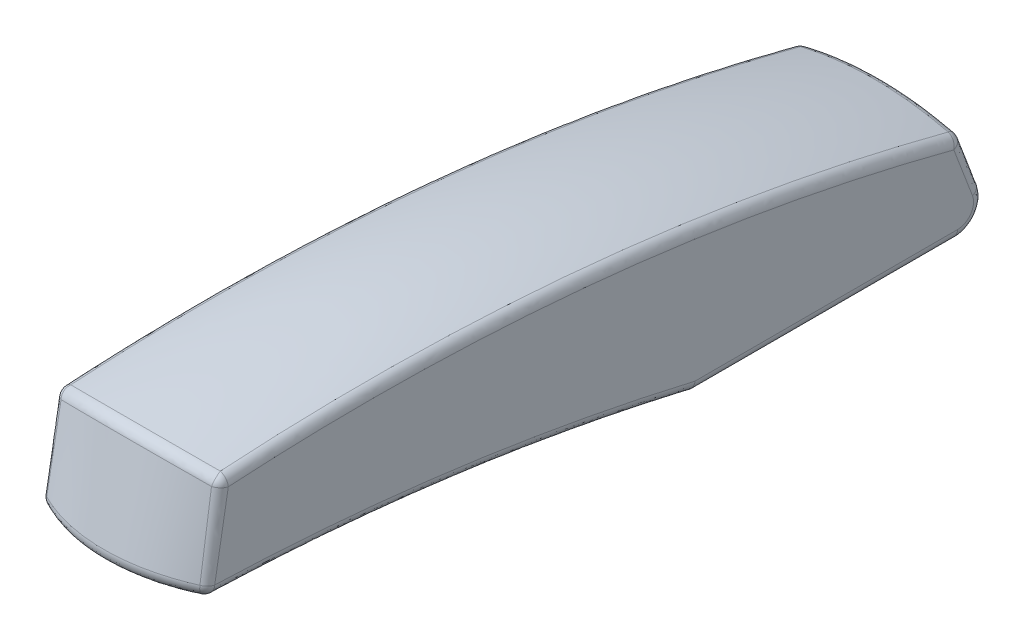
SolidWorks part; units mm, degrees
ref_plane "Front Plane" through (0, 0, 0) normal (0, 0, 1) x (1, 0, 0)
ref_plane "Top Plane" through (0, 0, 0) normal (0, 1, 0) x (1, 0, 0)
ref_plane "Right Plane" through (0, 0, 0) normal (1, 0, 0) x (0, 0, -1)
sketch "Sketch1" plane through (0, 0, 0) normal (1, 0, 0) x (0, 0, -1)
  line L2 (-91, 11.8614) -> (-88.1255, 29.8614)
  line L6 (0, 0) -> (56.5385, 0)
  line L7 (50.0745, 16.4998) -> (56.5385, 0)
  arc A1 (0, 0) -> (-91, 11.8614) centre (-103.1004, -435.9751) ccw
  arc A4 (-88.1255, 29.8614) -> (50.0745, 16.4998) centre (-59.8633, -399.2088) cw
  dimension "D7" = 430
  dimension "D2" = 50.0745
  dimension "D10" = 448
  dimension "D3" = 56.5385
  dimension "D4" = 59.8633
  dimension "D5" = 91
  dimension "D6" = 18
  dimension "D8" = 138.2
  dimension "D9" = 103.1004
ref_plane "Plane1" through (30.7, 0, 0) normal (1, 0, 0) x (0, 0, -1)
sketch "Sketch2" plane through (30.7, 0, 0) normal (1, 0, 0) x (0, 0, -1)
  line L0 (-88.1255, 29.8614) -> (-91, 11.8614)
  line L5 (0, 0) -> (56.5385, 0)
  line L7 (56.5385, 0) -> (50.0745, 16.4998)
  arc A0 (-91, 11.8614) -> (0, 0) centre (-103.1004, -435.9751) cw
  arc A2 (-88.1255, 29.8614) -> (50.0745, 16.4998) centre (-59.8633, -399.2088) cw
  dimension "D1" = 448
  dimension "D2" = 430
  dimension "D3" = 56.5385
ref_plane "Plane2" through (0, 0, 88.13) normal (0, 0, 1) x (1, 0, 0)
ref_plane "Plane3" through (0, 0, -50.07) normal (0, 0, 1) x (1, 0, 0)
sketch "Sketch5" plane through (0, 0, -50.07) normal (0, 0, 1) x (1, 0, 0)
  line L0 (30.7, 29.8614) -> (30.7, 11.8614) construction
  line L1 (0, 11.8614) -> (0, 29.8614) construction
  arc A0 (30.7, 16.4594) -> (0, 16.4594) centre (15.35, -38.4348) ccw
  dimension "D1" = 57
  dimension "D2" = 16.4594
ref_plane "Plane4" through (0, 0, 91) normal (0, 0, 1) x (1, 0, 0)
sketch "Sketch7" plane through (0, 0, 0) normal (0, 1, 0) x (1, 0, 0)
  line L0 (0, 0) -> (30.7, 0)
  line L1 (30.7, 0) -> (30.7, 56.5385) construction
sketch "Sketch8" plane through (0, 0, 0) normal (0, 1, 0) x (1, 0, 0)
  line L0 (0, 56.5385) -> (30.7, 56.5385)
  line L1 (0, 0) -> (0, 56.5385) construction
  line L2 (30.7, 0) -> (30.7, 56.5385) construction
  dimension "D1" = 56.5385
sketch "Sketch9" plane through (0, 0, 88.13) normal (0, 0, 1) x (1, 0, 0)
sketch "Sketch16" plane through (0, 0, 88.13) normal (0, 0, 1) x (1, 0, 0)
  line L0 (0, 29.8614) -> (30.7, 29.8614) construction
  line L1 (0, 11.8614) -> (0, 29.8614) construction
  line L2 (30.7, 29.8614) -> (30.7, 11.8614) construction
ref_plane "Plane9" through (0, -29.1343, 29.1343) normal (0, -0.7071, 0.7071) x (1, 0, 0)
sketch "Sketch17" plane through (0, -29.1343, 29.1343) normal (0, -0.7071, 0.7071) x (1, 0, 0)
  arc A0 (0, 83.4325) -> (30.7, 83.4325) centre (15.35, 51.9782) cw
  dimension "D1" = 35
ref_plane "Plane10" through (0, 3.8703, -0.3386) normal (0, -0.9962, 0.0872) x (1, 0, 0)
sketch "Sketch18" plane through (0, 3.8703, -0.3386) normal (0, -0.9962, 0.0872) x (1, 0, 0)
  arc A0 (-0.2904, 92.2166) -> (31.1985, 92.2166) centre (15.454, 66.6801) cw
  dimension "D1" = 30
loft "Loft11" add profiles "Sketch1", "Sketch2"
fillet "Fillet4" radius 5 1 edges
shell "Shell2" thickness 2.5
sketch "Sketch20" plane through (2.5, 0, 0) normal (1, 0, 0) x (0, 0, -1)
  line L0 (50.761, 15.2685) -> (53.9771, 6.7685)
  line L2 (51.4771, 4) -> (47.4771, 4)
  line L3 (47.4771, 4) -> (47.4771, 0)
  line L4 (0, 0) -> (49.2974, 0) construction
  line L5 (47.4771, 0) -> (46.4771, 0)
  line L6 (46.4771, 0) -> (46.4771, 16)
  line L8 (47.4771, 15.9) -> (47.4771, 10.4)
  line L9 (50.761, 15.2685) -> (49.761, 15.0856)
  line L10 (49.761, 15.0856) -> (51.9771, 9.2286)
  line L11 (51.4771, 4) -> (51.4771, 0.4994)
  line L12 (46.4771, 16) -> (47.4771, 15.9)
  arc A1 (51.9771, 9.2286) -> (47.4771, 10.4) centre (48.9071, 6.6644) ccw
  arc A3 (53.9771, 6.7685) -> (51.4771, 0.4994) centre (49.3, 5.0006) cw
  circle A6 centre (53.1271, 7.17) radius 0.5
  circle A7 centre (50.1271, 7.2) radius 2.25
  spline S0 degree 3 poles (53.9771, 6.7685) (53.0461, 9.229) (52.1153, 11.6897) (51.1846, 14.1504) knots 0 0 0 0 0.007892 0.007892 0.007892 0.007892 construction
  spline S1 degree 3 poles (53.9771, 6.7685) (54.1209, 6.3885) (54.216, 5.999) (54.2884, 5.4009) (54.3006, 5.1981) (54.3003, 4.7934) (54.2755, 4.3922) (54.2031, 3.998) (54.1067, 3.6073) (54.0459, 3.4125) (53.8309, 2.8469) (53.6446, 2.4924) (53.3006, 1.9942) (53.1747, 1.8337) (52.9078, 1.5327) (52.766, 1.3911) (52.3161, 0.9926) (51.9787, 0.7596) (51.2677, 0.3865) (50.8925, 0.2436) (50.104, 0.0487) (49.7037, 0) (49.2974, 0) knots 0 0 0 0 0.125 0.125 0.1875 0.1875 0.25 0.3125 0.3125 0.375 0.375 0.5 0.5 0.5625 0.5625 0.625 0.625 0.75 0.75 0.875 0.875 1 1 1 1 construction
  point P16 (47.4771, 7.2)
  point P20 (53.6271, 7.17)
  dimension "D3" = 5
  dimension "D9" = 4
  dimension "D10" = 4.5
  dimension "D12" = 1
  dimension "D1" = 1
  dimension "D2" = 1
  dimension "D4" = 4
  dimension "D5" = 4.5
  dimension "D6" = 4
  dimension "D7" = 16
  dimension "D8" = 5.5
  dimension "D11" = 3.2
  dimension "D13" = 0.35
  dimension "D14" = 3.17
  dimension "D15" = 3.2
  dimension "D16" = 7.5
  dimension "D17" = 1
  dimension "D18" = 8.5
  dimension "D19" = 1.85
extrude "Boss-Extrude5" add sketch "Sketch20" along normal blind 1.5
ref_plane "Plane11" through (15.35, 0, 0) normal (1, 0, 0) x (0, 0, -1)
surface "Surface-Loft4"
mirror "Mirror2" about plane through (15.35, 0, 0) normal (1, 0, 0) of "Boss-Extrude5"
loft "Loft13" add
sketch "Sketch25" plane through (15.35, 0, 0) normal (1, 0, 0) x (0, 0, -1)
  line L0 (-90.8759, 31.3683) -> (51.0614, 15.7196)
  line L1 (-90.6369, 32.3683) -> (-95.4458, 12.2504) construction
  dimension "D1" = 1
surface "Surface-Extrude3" sketch "Sketch25" parameters "D1"=45
ref_plane "Plane12" through (0, 50, 0) normal (0, -1, 0) x (-1, 0, 0)
sketch "Sketch28" plane through (0, 50, 0) normal (0, -1, 0) x (-1, 0, 0)
  line L0 (-28.2, 0) -> (-28.2, 46.4771) construction
  line L1 (-28.2, 30.1827) -> (-2.5, 30.1827)
  line L2 (-28.2, 30.1827) -> (-28.2, 29.1827)
  line L3 (-28.2, 29.1827) -> (-2.5, 29.1827)
  line L4 (-2.5, 30.1827) -> (-2.5, 29.1827)
  line L5 (-15.35, 29.1827) -> (-15.35, 30.1827) construction
  line L6 (-28.2, 29.6827) -> (-2.5, 29.6827) construction
  line L7 (-2.5, 0) -> (-2.5, 46.4771) construction
  line L8 (-28.2, 28.1827) -> (-15.35, 16.1999)
  line L9 (-28.2, -50.3173) -> (-2.5, -50.3173)
  line L10 (-28.2, -86.6733) -> (-28.2, 46.4771) construction
  line L11 (-28.2, 9.1827) -> (-22.875, 9.1827)
  line L12 (-28.2, 9.1827) -> (-28.2, 8.1827)
  line L13 (-28.2, 8.1827) -> (-23.9474, 8.1827)
  line L14 (-2.5, 9.1827) -> (-2.5, 8.1827)
  line L16 (-22.875, 8.1827) -> (-7.825, 8.1827)
  line L17 (-27.2582, -19.3173) -> (-4.4686, -19.3173)
  line L18 (-28.2, -19.3173) -> (-28.2, -20.3173)
  line L19 (-28.2, -20.3173) -> (-23.7, -20.3173)
  line L20 (-2.5, -19.3173) -> (-2.5, -20.3173)
  line L22 (-25.7, 1.9809) -> (-16.6766, -7.0709)
  line L23 (-2.5, 0) -> (-2.5, -89.5531) construction
  line L24 (-28.2, -50.3173) -> (-28.2, -51.3173)
  line L25 (-28.2, -51.3173) -> (-2.5, -51.3173)
  line L26 (-2.5, -50.3173) -> (-2.5, -51.3173)
  line L27 (-24.7, 1.9809) -> (-16.0068, -6.3592)
  line L28 (-27.2582, -19.3173) -> (-15.9593, -7.7905)
  line L29 (-2.5, 46.4771) -> (-2.5, -86.6733) construction
  line L30 (-28.2, 27.1827) -> (-15.8862, 15.6999)
  line L31 (-2.5, 3.2171) -> (-2.5, 4.2171)
  line L32 (-28.2, 28.1827) -> (-28.2, 27.1827)
  line L33 (-2.5, 28.1827) -> (-2.5, 27.1827)
  line L34 (-2.5, 27.1827) -> (-14.8138, 15.6999)
  line L35 (-2.5, 28.1827) -> (-15.35, 16.1999)
  line L36 (-28.2, 4.2171) -> (-28.2, 3.2171)
  line L37 (-15.8862, 15.6999) -> (-22.875, 9.1827)
  line L38 (-15.35, 15.1999) -> (-21.8026, 9.1827)
  line L39 (-14.8138, 15.6999) -> (-7.825, 9.1827)
  line L40 (-15.35, 15.1999) -> (-8.8974, 9.1827)
  line L41 (-23.9474, 8.1827) -> (-28.2, 4.2171)
  line L42 (-22.875, 8.1827) -> (-24.7, 6.4809)
  line L43 (-21.8026, 9.1827) -> (-8.8974, 9.1827)
  line L45 (-7.825, 8.1827) -> (-4.8946, 5.4501)
  line L46 (-6.7526, 8.1827) -> (-2.5, 4.2171)
  line L47 (-7.825, 9.1827) -> (-2.5, 9.1827)
  line L48 (-6.7526, 8.1827) -> (-2.5, 8.1827)
  line L49 (-3.8946, 4.5176) -> (-2.5, 3.2171)
  line L51 (-16.6766, -7.0709) -> (-28.2, -19.3173)
  line L54 (-24.7, 6.4809) -> (-24.7, 1.9809)
  line L55 (-25.7, 5.5484) -> (-25.7, 1.9809)
  line L56 (-4.8946, 5.4501) -> (-16.0068, -6.3592)
  line L57 (-15.2593, -7.0763) -> (-3.8946, 4.5176)
  line L58 (-15.2593, -7.0763) -> (-2.5, -19.3173)
  line L59 (-25.7, 5.5484) -> (-28.2, 3.2171)
  line L60 (-15.9593, -7.7905) -> (-4.4686, -19.3173)
  line L64 (-22.7, -20.3173) -> (-15.6761, -28.8363)
  line L65 (-23.7, -20.3173) -> (-16.1329, -29.4192)
  line L66 (-2.5, -45.8173) -> (-2.5, -44.8173)
  line L67 (-22.7, -20.3173) -> (-9, -20.3173)
  line L68 (-8, -20.3173) -> (-15.203, -29.4102)
  line L69 (-28.2, -89.5531) -> (-28.2, 0) construction
  line L70 (-28.2, -45.8173) -> (-28.2, -44.8173)
  line L71 (-28.2, -44.8173) -> (-16.1329, -29.4192)
  line L72 (-8, -20.3173) -> (-2.5, -20.3173)
  line L73 (0, -91) -> (0, 0) construction
  line L74 (-15.8526, -38.1173) -> (-14.8526, -38.1173)
  line L75 (-15.8526, -38.1173) -> (-15.8526, -41.4673)
  line L76 (-15.8526, -45.8173) -> (-14.8526, -45.8173)
  line L77 (-14.8526, -38.1173) -> (-14.8526, -41.4673)
  line L78 (-15.6761, -28.8363) -> (-9, -20.3173)
  line L80 (-19.2026, -41.4673) -> (-15.8526, -41.4673)
  line L81 (-19.2026, -41.4673) -> (-19.2026, -42.4673)
  line L82 (-19.2026, -42.4673) -> (-15.8526, -42.4673)
  line L83 (-11.5026, -41.4673) -> (-11.5026, -42.4673)
  line L84 (-15.6604, -29.9876) -> (-28.2, -45.8173)
  line L85 (-15.203, -29.4102) -> (-2.5, -44.8173)
  line L86 (0, 0) -> (0, 49.1965) construction
  line L87 (-15.6604, -29.9876) -> (-2.5, -45.8173)
  line L88 (-14.8526, -41.4673) -> (-11.5026, -41.4673)
  line L89 (-15.3548, -42.4673) -> (-15.3526, -42.4673)
  line L90 (-14.8526, -42.4673) -> (-11.5026, -42.4673)
  line L91 (-15.8526, -42.4673) -> (-15.8526, -45.8173)
  line L95 (-14.8526, -42.4673) -> (-14.8526, -45.8173)
  circle A0 centre (-15.3548, -42.0376) radius 4.0118
  spline S0 degree 3 poles (-28.2, 51.1846) (-26.0965, 51.1393) (-23.9715, 51.1096) (-20.7525, 51.0803) (-19.6725, 51.0732) (-17.5113, 51.0638) (-15.3502, 51.0591) (-13.1893, 51.0638) (-11.0285, 51.0732) (-9.9482, 51.0803) (-6.7287, 51.1096) (-4.6035, 51.1393) (-2.5, 51.1846) knots 0 0 0 0 0.25 0.25 0.375 0.375 0.5 0.625 0.625 0.75 0.75 1 1 1 1 construction
  point P12 (-2.5903, 51.1827)
  point P80 (-16.1329, -29.4192)
  point P81 (-15.203, -29.4102)
  point P169 (-15.35, -50.8705)
  point P292 (-15.35, 29.6827)
  dimension "D1" = 1
  dimension "D2" = 21
  dimension "D3" = 1
  dimension "D4" = 20
  dimension "D5" = 27.5
  dimension "D6" = 1
  dimension "D7" = 1
  dimension "D8" = 30
  dimension "D9" = 1
  dimension "D10" = 1
  dimension "D11" = 1
  dimension "D12" = 4.5
  dimension "D13" = 1
  dimension "D14" = 1
  dimension "D15" = 5.5
  dimension "D16" = 1
  dimension "D17" = 1
  dimension "D18" = 5.5
  dimension "D19" = 1
  dimension "D20" = 1
  dimension "D21" = 7.7
  dimension "D22" = 7.7
  dimension "D23" = 1
  dimension "D24" = 1
  dimension "D25" = 4.5
  dimension "D26" = 4.5
  dimension "D27" = 11.5026
  dimension "D28" = 43
  dimension "D29" = 94
  dimension "D30" = 86
  dimension "D31" = 94
  dimension "D32" = 1
  dimension "D33" = 2.5
  dimension "D34" = 3.9656
  dimension "D35" = 1
  dimension "D36" = 1
  dimension "D37" = 102.5
  dimension "D38" = 137
  dimension "D39" = 2.7326
  dimension "D40" = 30.1827
  dimension "D41" = 16.6766
  dimension "D42" = 90
  dimension "D43" = 7.0709
  dimension "D44" = 4.5
  dimension "D45" = 7.7
  dimension "D46" = 3.35
  dimension "D47" = 3.35
  dimension "D48" = 3.35
  dimension "D49" = 3.35
  dimension "D50" = 1
  dimension "D51" = 90
  dimension "D52" = 47
  dimension "D53" = 11.4828
  dimension "D54" = 18
  dimension "D55" = 90
  dimension "D56" = 5.5
  dimension "D57" = 1
  dimension "D58" = 4.8946
extrude "Boss-Extrude26" add sketch "Sketch28" along normal up to surface (22.9931 mm away) contours L26 L9 L24 L25 | L84 L87 L66 L85 L68 L72 L20 L58 L57 L49 L31 L46 L48 L14 L47 L39 L34 L33 L35 L8 L32 L30 L37 L11 L12 L13 L41 L36 L59 L55 L22 L51 L18 L19 L65 L71 L70 L28 L60 L17 L45 L56 L27 L54 L42 L16 L43 L38 | L77 L88 L83 L90 L95 L76 L91 L82 L81 L80 L75 L74 | L1 L4 L3 L2
other "DeleteFace18"
other "DeleteFace21"
delete or keep bodies "Body-Delete/Keep 4" type delete bodies bodies 119
sketch "Sketch32" plane through (0, 21.0928, -2.3255) normal (0, -0.994, 0.1096) x (1, 0, 0)
  line L0 (28.2, 52.9618) -> (2.5, 52.9618) construction
  line L1 (2.5, 53.9678) -> (8, 53.9678)
  line L2 (2.5, 53.9678) -> (2.5, 52.9618)
  line L3 (2.5, 52.9618) -> (8, 52.9618)
  line L4 (8, 53.9678) -> (8, 52.9618)
  line L5 (5.25, 52.9618) -> (5.25, 53.9678) construction
  line L6 (2.5, 53.4648) -> (8, 53.4648) construction
  line L7 (27.2582, 21.7739) -> (4.4686, 21.7739) construction
  line L8 (28.2, 53.9678) -> (22.7, 53.9678)
  line L9 (28.2, 53.9678) -> (28.2, 52.9618)
  line L10 (28.2, 52.9618) -> (22.7, 52.9618)
  line L11 (22.7, 53.9678) -> (22.7, 52.9618)
  line L12 (25.45, 52.9618) -> (25.45, 53.9678) construction
  line L13 (28.2, 53.4648) -> (22.7, 53.4648) construction
  line L14 (2.5, 22.78) -> (8, 22.78)
  line L15 (2.5, 22.78) -> (2.5, 21.7739)
  line L16 (2.5, 21.7739) -> (8, 21.7739)
  line L17 (8, 22.78) -> (8, 21.7739)
  line L18 (5.25, 21.7739) -> (5.25, 22.78) construction
  line L19 (2.5, 22.277) -> (8, 22.277) construction
  line L21 (28.2, 22.78) -> (22.7, 22.78)
  line L22 (28.2, 22.78) -> (28.2, 21.7739)
  line L23 (28.2, 21.7739) -> (22.7, 21.7739)
  line L24 (22.7, 22.78) -> (22.7, 21.7739)
  line L25 (25.45, 21.7739) -> (25.45, 22.78) construction
  line L26 (28.2, 22.277) -> (22.7, 22.277) construction
  point P204 (25.45, 22.277)
  point P404 (5.25, 53.4648)
  point P460 (25.45, 53.4648)
  point P682 (5.25, 22.277)
  dimension "D1" = 5.5
  dimension "D2" = 5.5
  dimension "D3" = 5.5
  dimension "D4" = 5.5
extrude "Boss-Extrude27" add sketch "Sketch32" along normal up to surface (17.921 mm away)
sketch "Sketch33" plane through (0, 21.0928, -2.3255) normal (0, -0.994, 0.1096) x (1, 0, 0)
  line L0 (6.7526, -5.8927) -> (2.5, -5.8927) construction
  line L1 (4, -5.8927) -> (2.5, -5.8927)
  line L2 (4, -5.8927) -> (4, -7.2072)
  line L3 (4, -7.2072) -> (2.5, -7.2072)
  line L4 (2.5, -5.8927) -> (2.5, -7.2072)
  line L5 (3.25, -7.2072) -> (3.25, -5.8927) construction
  line L6 (4, -6.5499) -> (2.5, -6.5499) construction
  line L7 (2.5, -24.8416) -> (2.5, -6.5825) construction
  line L8 (2.5, 0) -> (2.5, -46.1972) construction
  line L9 (0, 0) -> (0, -48.9002) construction
  line L10 (28.2, -6.8988) -> (22.875, -6.8988) construction
  line L11 (28.2, -5.8927) -> (26.7, -5.8927)
  line L12 (28.2, -5.8927) -> (28.2, -6.8988)
  line L13 (28.2, -6.8988) -> (26.7, -6.8988)
  line L14 (26.7, -5.8927) -> (26.7, -6.8988)
  line L15 (27.45, -6.8988) -> (27.45, -5.8927) construction
  line L16 (28.2, -6.3957) -> (26.7, -6.3957) construction
  line L17 (30.7, 0) -> (30.7, -48.9002) construction
  point P136 (27.45, -6.3957)
  point P332 (3.25, -6.5499)
  dimension "D1" = 4
  dimension "D2" = 4
extrude "Boss-Extrude28" add sketch "Sketch33" along normal up to surface (20.5709 mm away)
sketch "Sketch35" plane through (0, -0.6458, -5.8572) normal (0, 0.1096, 0.994) x (1, 0, 0)
  line L0 (2.5, 0.6497) -> (4, 6.6497)
  line L1 (4, 0.6497) -> (4, 21.2206) construction
  line L2 (4, 6.6497) -> (4, 0.6497)
  line L3 (4, 0.6497) -> (2.5, 0.6497)
  line L4 (28.2, 0.6497) -> (26.7, 0.6497)
  line L5 (26.7, 0.6497) -> (26.7, 6.6497)
  line L6 (26.7, 0.6497) -> (26.7, 21.2206) construction
  line L7 (26.7, 6.6497) -> (28.2, 0.6497)
  dimension "D1" = 6
  dimension "D2" = 6
extrude "Cut-Extrude1" cut sketch "Sketch35" against normal blind 10
fillet "Fillet5" radius 2 15 edges at (0, 2.0262, -53.2201) (30.7, 2.3535, -53.443)
sketch "Sketch36" plane through (2.5, 0, 0) normal (1, 0, 0) x (0, 0, -1)
  line L1 (-80.8044, 27.0981) -> (-79.9544, 27.0981)
  line L2 (-80.8044, 27.0981) -> (-80.8044, 19.0981)
  line L3 (-80.8044, 19.0981) -> (-79.9544, 19.0981)
  line L4 (-79.9544, 27.0981) -> (-79.9544, 19.0981)
  line L5 (-80.3794, 19.0981) -> (-80.3794, 27.0981) construction
  line L6 (-80.8044, 23.0981) -> (-79.9544, 23.0981) construction
  line L7 (-78.4294, 27.0981) -> (-77.5794, 27.0981)
  line L8 (-78.4294, 27.0981) -> (-78.4294, 19.0981)
  line L9 (-78.4294, 19.0981) -> (-77.5794, 19.0981)
  line L10 (-77.5794, 27.0981) -> (-77.5794, 19.0981)
  line L11 (-78.0044, 19.0981) -> (-78.0044, 27.0981) construction
  line L12 (-78.4294, 23.0981) -> (-77.5794, 23.0981) construction
  line L13 (-76.0544, 27.0981) -> (-75.2044, 27.0981)
  line L14 (-76.0544, 27.0981) -> (-76.0544, 19.0981)
  line L15 (-76.0544, 19.0981) -> (-75.2044, 19.0981)
  line L16 (-75.2044, 27.0981) -> (-75.2044, 19.0981)
  line L17 (-75.6294, 19.0981) -> (-75.6294, 27.0981) construction
  line L18 (-76.0544, 23.0981) -> (-75.2044, 23.0981) construction
  point P172 (-78.0044, 23.0981)
  point P228 (-80.3794, 23.0981)
  point P358 (-75.6294, 23.0981)
  dimension "D1" = 0.85
  dimension "D2" = 0.85
  dimension "D3" = 0.85
  dimension "D4" = 5.6
  dimension "D5" = 1.525
  dimension "D6" = 1.525
  dimension "D7" = 8
  dimension "D8" = 8
  dimension "D9" = 8
  dimension "D10" = 8.7487
  dimension "D11" = 36.2754
  dimension "D12" = 2.6704
  dimension "D13" = 9.8725
extrude "Boss-Extrude29" add sketch "Sketch36" along normal blind 6.5
sketch "Sketch38" plane through (0, 0, 80.8044) normal (0, 0, 1) x (1, 0, 0)
  line L0 (5.75, 19.0981) -> (9, 23.0981)
  line L1 (9, 19.0981) -> (2.5, 19.0981) construction
  line L2 (9, 27.0981) -> (9, 19.0981) construction
  line L3 (9, 23.0981) -> (9, 19.0981)
  line L4 (9, 19.0981) -> (5.75, 19.0981)
extrude "Cut-Extrude2" cut sketch "Sketch38" against normal blind 6.5
mirror "Mirror3" about plane through (15.35, 0, 0) normal (1, 0, 0) of "Boss-Extrude29"
sketch "Sketch39" plane through (0, 0, 80.8044) normal (0, 0, 1) x (1, 0, 0)
  line L0 (24.95, 19.0981) -> (21.7, 19.0981)
  line L1 (21.7, 19.0981) -> (28.2, 19.0981) construction
  line L2 (21.7, 19.0981) -> (21.7, 23.0981)
  line L3 (21.7, 27.0981) -> (21.7, 19.0981) construction
  line L4 (21.7, 23.0981) -> (24.95, 19.0981)
extrude "Cut-Extrude3" cut sketch "Sketch39" against normal blind 6.5
sketch "Sketch41" plane through (0, 0, 91) normal (0, 0, 1) x (1, 0, 0)
  line L0 (21.7, 23.0981) -> (21.7, 27.0981) construction
  line L2 (20.95, 31.0981) -> (20.95, 23.0981)
  line L4 (20.05, 31.0981) -> (20.05, 23.0981)
  line L5 (20.5, 23.0981) -> (20.5, 31.0981) construction
  line L6 (20.95, 23.0981) -> (20.05, 23.0981)
  line L8 (18.35, 31.0981) -> (18.35, 23.0981)
  line L10 (17.45, 31.0981) -> (17.45, 23.0981)
  line L11 (17.9, 23.0981) -> (17.9, 31.0981) construction
  line L12 (18.35, 23.0981) -> (17.45, 23.0981)
  line L26 (20.95, 31.0981) -> (20.05, 31.0981)
  line L27 (9, 23.0981) -> (2.5, 23.0981) construction
  line L28 (2.5, 19.0981) -> (2.5, 27.0981) construction
  line L29 (18.35, 31.0981) -> (17.45, 31.0981)
  point P240 (17.9, 23.0981)
  point P460 (20.5, 23.0981)
  dimension "D1" = 0.9
  dimension "D2" = 0.9
  dimension "D3" = 8
  dimension "D5" = 1.7
  dimension "D7" = 0.75
extrude "Boss-Extrude34" add sketch "Sketch41" against normal blind 7.5 contours L29 L10 L12 L8 | L26 L4 L6 L2
sketch "Sketch43" plane through (0, 0, 83.5) normal (0, 0, -1) x (-1, 0, 0)
  line L0 (-17.45, 26.5171) -> (-18.35, 26.4927)
  line L1 (-17.45, 29.9362) -> (-17.45, 23.0981) construction
  line L2 (-18.35, 29.8874) -> (-18.35, 23.0981) construction
  line L3 (-18.35, 26.4927) -> (-18.35, 31.7459)
  line L4 (-18.35, 31.7459) -> (-17.45, 31.7459)
  line L5 (-17.45, 31.7459) -> (-17.45, 26.5171)
  line L6 (-18.35, 30.1482) -> (-18.35, 23.0981) construction
  line L7 (-18.35, 23.0981) -> (-17.45, 23.0981) construction
  dimension "D1" = 0.9
  dimension "D2" = 7.0501
  dimension "D3" = 8.6478
extrude "Boss-Extrude37" add sketch "Sketch43" along normal blind 8
mirror "Mirror5" about plane through (15.35, 0, 0) normal (1, 0, 0) of "Boss-Extrude37", "Boss-Extrude34"
other "DeleteFace23"
ref_plane "Plane13" through (-0.8304, 30.6371, 0) normal (0.0271, -0.9996, 0) x (-0.9996, -0.0271, 0)
sketch "Sketch44" plane through (-0.8304, 30.6371, 0) normal (0.0271, -0.9996, 0) x (-0.9996, -0.0271, 0)
  line L0 (-13.9636, -75.5) -> (-13.9636, -83.5) construction
  line L1 (-17.6621, -82.15) -> (-17.0621, -82.15)
  line L2 (-17.6621, -82.15) -> (-17.6621, -78.75)
  line L3 (-17.6621, -78.75) -> (-14.4636, -78.75)
  line L4 (-14.4636, -82.15) -> (-14.4636, -78.75)
  line L5 (-19.0611, -75.5) -> (-18.1621, -75.5) construction
  line L6 (-12.9713, -83.5) -> (-13.871, -83.5) construction
  line L7 (-18.1621, -75.5) -> (-18.1621, -83.5) construction
  line L8 (-17.0621, -82.15) -> (-17.0621, -79.6063)
  line L9 (-17.0621, -79.6063) -> (-15.0636, -79.6063)
  line L10 (-15.0636, -79.6063) -> (-15.0636, -82.15)
  line L11 (-15.0636, -82.15) -> (-14.4636, -82.15)
  line L12 (-15.2136, -69.35) -> (-14.4636, -69.35)
  line L13 (-17.6621, -69.35) -> (-16.9121, -69.35)
  line L14 (-17.6621, -69.35) -> (-17.6621, -76.85)
  line L15 (-17.6621, -76.85) -> (-14.4636, -76.85)
  line L16 (-14.4636, -69.35) -> (-14.4636, -76.85)
  line L17 (-13.0633, -75.5) -> (-13.9636, -75.5) construction
  line L20 (-16.9121, -69.35) -> (-16.9121, -76.05)
  line L21 (-16.9121, -76.05) -> (-15.2136, -76.05)
  line L22 (-15.2136, -69.35) -> (-15.2136, -76.05)
  point P629 (-16.0628, -68.6747)
  dimension "D1" = 0.5
  dimension "D2" = 0.5
  dimension "D3" = 0.6
  dimension "D4" = 0.6
  dimension "D5" = 0.8563
  dimension "D6" = 3.25
  dimension "D7" = 1.35
  dimension "D8" = 7.5
  dimension "D9" = 1.9
  dimension "D10" = 0.75
  dimension "D11" = 0.75
  dimension "D12" = 0.55
extrude "Boss-Extrude38" add sketch "Sketch44" along normal blind 4.65
fillet "Fillet6" radius 0.5 4 edges at (14.2995, 28.3963, 79.6063) (16.2979, 28.4256, 79.6063) (16.8977, 28.4414, 78.75) (13.6993, 28.3944, 78.75)
sketch "Sketch46" plane through (17.6556, 0.4785, 0) normal (0.9996, 0.0271, 0) x (0, 0, -1)
  line L0 (-69.35, 30.178) -> (-76.05, 25.9984)
  line L1 (-69.35, 25.9984) -> (-69.35, 30.178) construction
  line L2 (-69.35, 25.9984) -> (-76.85, 25.9984) construction
  line L3 (-76.05, 25.9984) -> (-69.35, 25.9984)
  line L4 (-69.35, 25.9984) -> (-69.35, 30.178)
  arc A0 (-69.35, 30.178) -> (-76.85, 30.0105) centre (-63.2254, -412.0123) ccw construction
  dimension "D1" = 0.8
extrude "Cut-Extrude4" cut sketch "Sketch46" against normal blind 3.25
sketch "Sketch48" plane through (0, 0, 75.2044) normal (0, 0, -1) x (-1, 0, 0)
  line L0 (-21.7, 23.0981) -> (-21.7, 27.0981) construction
  line L1 (-28.2, 27.0981) -> (-21.7, 27.0981)
  line L2 (-28.2, 27.0981) -> (-28.2, 25.0981)
  line L3 (-28.2, 25.0981) -> (-21.7, 25.0981)
  line L4 (-21.7, 27.0981) -> (-21.7, 25.0981)
  line L5 (-24.95, 25.0981) -> (-24.95, 27.0981) construction
  line L6 (-28.2, 26.0981) -> (-21.7, 26.0981) construction
  line L7 (-9, 27.0981) -> (-2.5, 27.0981) construction
  line L8 (-2.5, 27.0981) -> (-9, 27.0981)
  line L9 (-2.5, 27.0981) -> (-2.5, 25.0981)
  line L10 (-2.5, 25.0981) -> (-9, 25.0981)
  line L11 (-9, 27.0981) -> (-9, 25.0981)
  line L12 (-5.75, 25.0981) -> (-5.75, 27.0981) construction
  line L13 (-2.5, 26.0981) -> (-9, 26.0981) construction
  line L14 (-2.5, 28.1603) -> (-2.5, 11.896) construction
  line L15 (-9, 23.0981) -> (-9, 27.0981) construction
  point P226 (-5.75, 26.0981)
  point P672 (-24.95, 26.0981)
extrude "Boss-Extrude39" add sketch "Sketch48" against normal blind 5.25
ref_plane "Plane14" through (0, 24.8202, -2.7365) normal (0, -0.994, 0.1096) x (-1, 0, 0)
sketch "Sketch50" plane through (0, 24.8202, -2.7365) normal (0, -0.994, 0.1096) x (-1, 0, 0)
  circle A0 centre (-15.4307, -44.7808) radius 4.25
  point P8 (-15.4307, -44.7808)
  dimension "D1" = 8.5
  dimension "D2" = 15.4307
  dimension "D3" = 44.7808
sketch "Sketch52" plane through (0, 21.0928, -2.3255) normal (0, -0.994, 0.1096) x (1, 0, 0)
  circle A0 centre (15.4419, 44.5152) radius 3.9215
